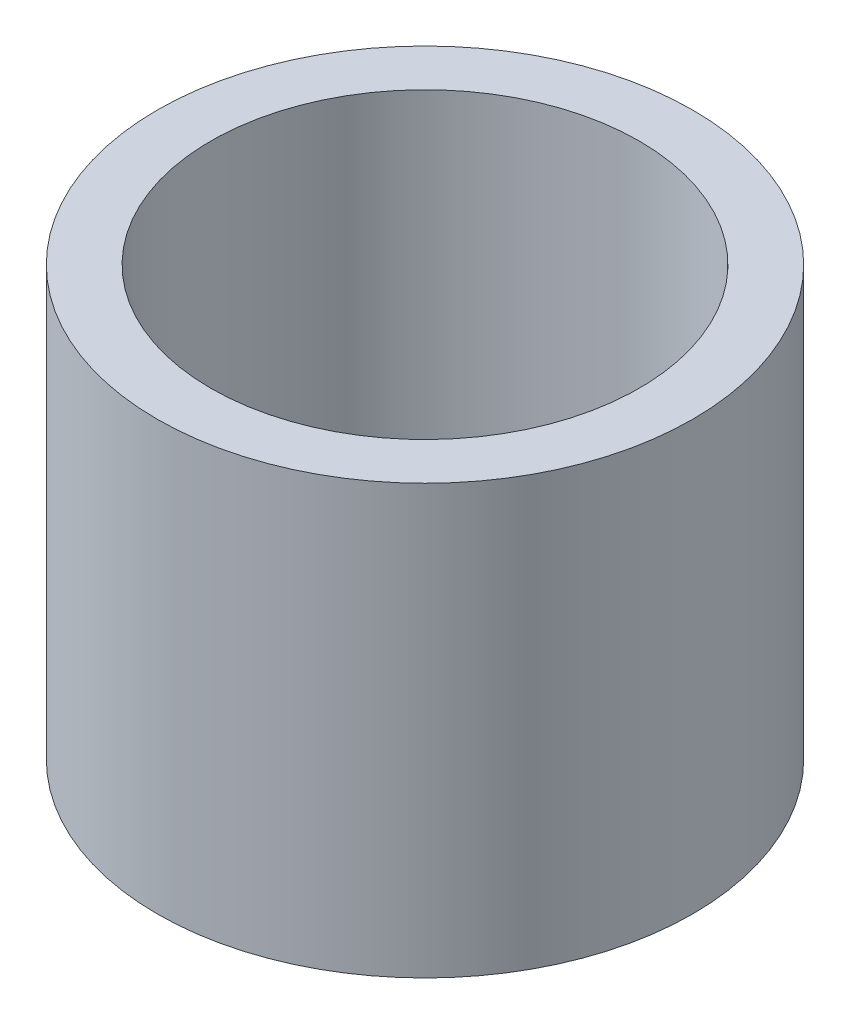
SolidWorks part; units mm, degrees
ref_plane "Plan de face" through (0, 0, 0) normal (0, 0, 1) x (1, 0, 0)
ref_plane "Plan de dessus" through (0, 0, 0) normal (0, 1, 0) x (1, 0, 0)
ref_plane "Plan de droite" through (0, 0, 0) normal (1, 0, 0) x (0, 0, -1)
sketch "Esquisse1" plane through (0, 0, 0) normal (0, 1, 0) x (1, 0, 0)
  circle A0 centre (0, 0) radius 12.5
  circle A1 centre (0, 0) radius 10
  dimension "D1" = 25
  dimension "D2" = 20
extrude "Extrusion1" add sketch "Esquisse1" against normal blind 20
